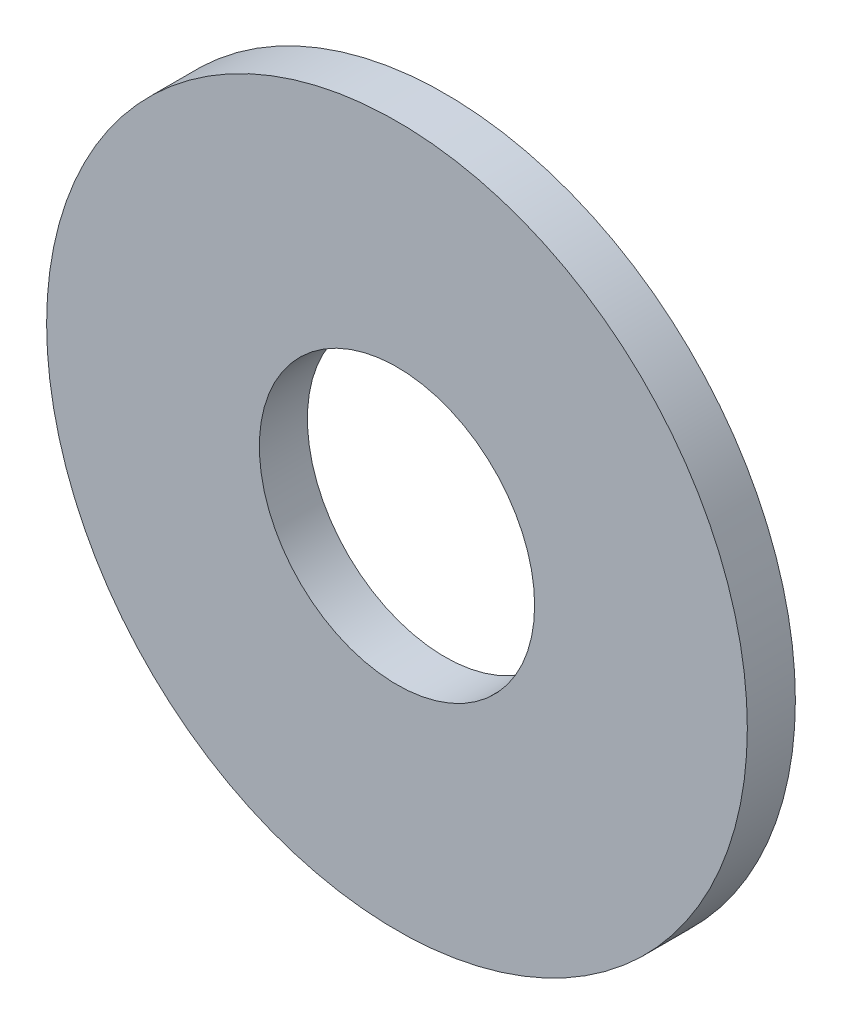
SolidWorks part; units mm, degrees
ref_plane "Front Plane" through (0, 0, 0) normal (0, 0, 1) x (1, 0, 0)
ref_plane "Top Plane" through (0, 0, 0) normal (0, 1, 0) x (1, 0, 0)
ref_plane "Right Plane" through (0, 0, 0) normal (1, 0, 0) x (0, 0, -1)
sketch "Sketch1" plane through (0, 0, 0) normal (0, 0, 1) x (1, 0, 0)
  circle A0 centre (0, 0) radius 8.7312
  circle A1 centre (0, 0) radius 22.225
  dimension "ID" = 17.4625
  dimension "OD" = 44.45
extrude "Extrude1" add sketch "Sketch1" against normal blind 3.048
